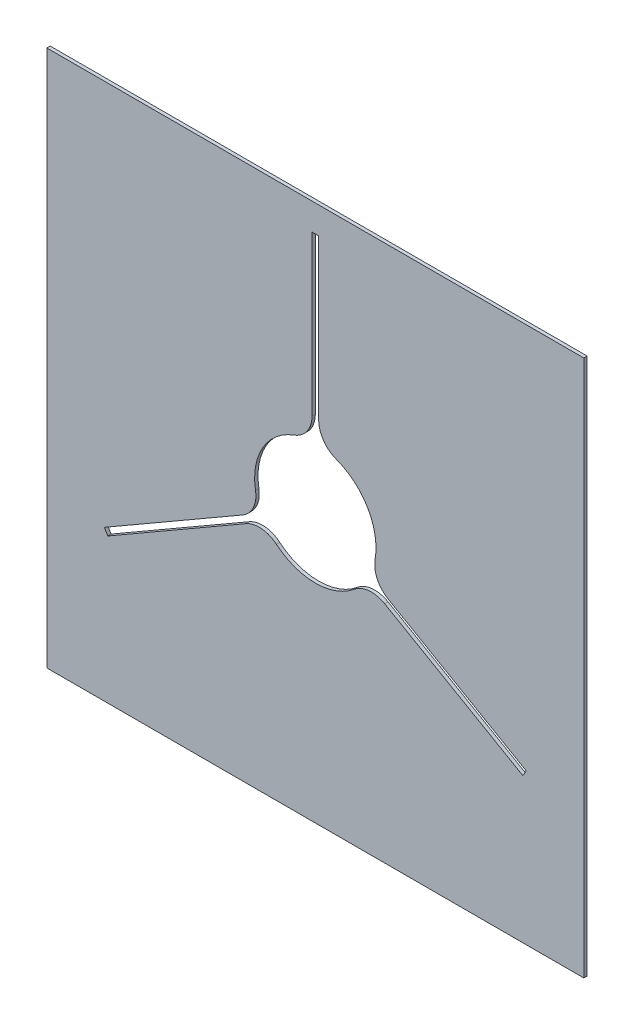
SolidWorks part; units mm, degrees
ref_plane "Front Plane" through (0, 0, 0) normal (0, 0, 1) x (1, 0, 0)
ref_plane "Top Plane" through (0, 0, 0) normal (0, 1, 0) x (1, 0, 0)
ref_plane "Right Plane" through (0, 0, 0) normal (1, 0, 0) x (0, 0, -1)
sketch "Sketch1" plane through (0, 0, 0) normal (0, 0, 1) x (1, 0, 0)
  line L1 (-127, 127) -> (127, 127)
  line L2 (-127, 127) -> (-127, -127)
  line L3 (-127, -127) -> (127, -127)
  line L4 (127, 127) -> (127, -127)
  line L5 (-127, 127) -> (127, -127) construction
  line L6 (-127, -127) -> (127, 127) construction
  point P0 (0, 0)
  dimension "D1" = 254
  dimension "D2" = 254
extrude "Boss-Extrude1" add sketch "Sketch1" along normal blind 1.5875
sketch "Sketch3" plane through (0, 0, 1.5875) normal (0, 0, 1) x (1, 0, 0)
  circle A0 centre (0, 0) radius 28.702
  dimension "D1" = 57.404
extrude "Cut-Extrude2" cut sketch "Sketch3" against normal through all
sketch "Sketch4" plane through (0, 0, 1.5875) normal (0, 0, 1) x (1, 0, 0)
  line L0 (0, 0) -> (0, 127) construction
  line L1 (127, 127) -> (-127, 127) construction
  line L3 (-1.5875, 114.3) -> (1.5875, 114.3)
  line L4 (-1.5875, 114.3) -> (-1.5875, 0)
  line L5 (-1.5875, 0) -> (1.5875, 0)
  line L6 (1.5875, 114.3) -> (1.5875, 0)
  line L7 (-1.5875, 114.3) -> (1.5875, 0) construction
  line L8 (-1.5875, 0) -> (1.5875, 114.3) construction
  point P5 (0, 57.15)
  dimension "D1" = 3.175
  dimension "D2" = 57.15
  dimension "D3" = 114.3
extrude "Cut-Extrude3" cut sketch "Sketch4" against normal through all
fillet "Fillet1" radius 12.7 2 edges at (1.5875, 28.6581, 0.7937) (-1.5875, 28.6581, 0.7937)
pattern_circular "CirPattern2" count 3 over 360 about axis through (0, 0, 0) along (0, 0, 1) of "Cut-Extrude3", "Fillet1"
sketch "Sketch5" plane through (0, 0, 1.5875) normal (0, 0, 1) x (1, 0, 0)
  line L8 (127.254, -127.254) -> (127.254, 127.254)
  line L9 (127.254, 127.254) -> (-127.254, 127.254)
  line L10 (-127.254, 127.254) -> (-127.254, -127.254)
  line L11 (-127.254, -127.254) -> (127.254, -127.254)
  line L12 (127.254, -127.254) -> (127.254, 127.254)
  line L13 (127.254, 127.254) -> (-127.254, 127.254)
  line L14 (-127.254, 127.254) -> (-127.254, -127.254)
  line L15 (-127.254, -127.254) -> (127.254, -127.254)
  line L39 (98.1, -58.1778) -> (99.4335, -55.8682)
  line L40 (-34.3193, -18.2745) -> (-99.4335, -55.8682)
  line L41 (-99.4335, -55.8682) -> (-98.1, -58.1778)
  line L42 (-98.1, -58.1778) -> (-32.9858, -20.5842)
  line L43 (32.9858, -20.5842) -> (98.1, -58.1778)
  line L44 (99.4335, -55.8682) -> (34.3193, -18.2745)
  line L45 (1.3335, 38.8586) -> (1.3335, 114.046)
  line L46 (1.3335, 114.046) -> (-1.3335, 114.046)
  line L47 (-1.3335, 114.046) -> (-1.3335, 38.8586)
  line L48 (98.1, -58.1778) -> (99.4335, -55.8682)
  line L49 (-34.3193, -18.2745) -> (-99.4335, -55.8682)
  line L50 (-99.4335, -55.8682) -> (-98.1, -58.1778)
  line L51 (-98.1, -58.1778) -> (-32.9858, -20.5842)
  line L52 (32.9858, -20.5842) -> (98.1, -58.1778)
  line L53 (99.4335, -55.8682) -> (34.3193, -18.2745)
  line L54 (1.3335, 38.8586) -> (1.3335, 114.046)
  line L55 (1.3335, 114.046) -> (-1.3335, 114.046)
  line L56 (-1.3335, 114.046) -> (-1.3335, 38.8586)
  arc A27 (-34.3193, -18.2745) -> (-28.0318, -4.8483) centre (-40.7963, -7.056) ccw
  arc A28 (-18.2146, -21.8521) -> (-32.9858, -20.5842) centre (-26.5088, -31.8027) ccw
  arc A29 (-18.2146, -21.8521) -> (18.2146, -21.8521) centre (0, 0) ccw
  arc A30 (32.9858, -20.5842) -> (18.2146, -21.8521) centre (26.5088, -31.8027) ccw
  arc A31 (28.0318, -4.8483) -> (34.3193, -18.2745) centre (40.7963, -7.056) ccw
  arc A32 (28.0318, -4.8483) -> (9.8172, 26.7004) centre (0, 0) ccw
  arc A33 (1.3335, 38.8586) -> (9.8172, 26.7004) centre (14.2875, 38.8586) ccw
  arc A34 (-9.8172, 26.7004) -> (-1.3335, 38.8586) centre (-14.2875, 38.8586) ccw
  arc A35 (-9.8172, 26.7004) -> (-28.0318, -4.8483) centre (0, 0) ccw
  arc A36 (-34.3193, -18.2745) -> (-28.0318, -4.8483) centre (-40.7963, -7.056) ccw
  arc A37 (-18.2146, -21.8521) -> (-32.9858, -20.5842) centre (-26.5088, -31.8027) ccw
  arc A38 (-18.2146, -21.8521) -> (18.2146, -21.8521) centre (0, 0) ccw
  arc A39 (32.9858, -20.5842) -> (18.2146, -21.8521) centre (26.5088, -31.8027) ccw
  arc A40 (28.0318, -4.8483) -> (34.3193, -18.2745) centre (40.7963, -7.056) ccw
  arc A41 (28.0318, -4.8483) -> (9.8172, 26.7004) centre (0, 0) ccw
  arc A42 (1.3335, 38.8586) -> (9.8172, 26.7004) centre (14.2875, 38.8586) ccw
  arc A43 (-9.8172, 26.7004) -> (-1.3335, 38.8586) centre (-14.2875, 38.8586) ccw
  arc A44 (-9.8172, 26.7004) -> (-28.0318, -4.8483) centre (0, 0) ccw
  dimension "D1" = 0.254
  dimension "D2" = 0.254
